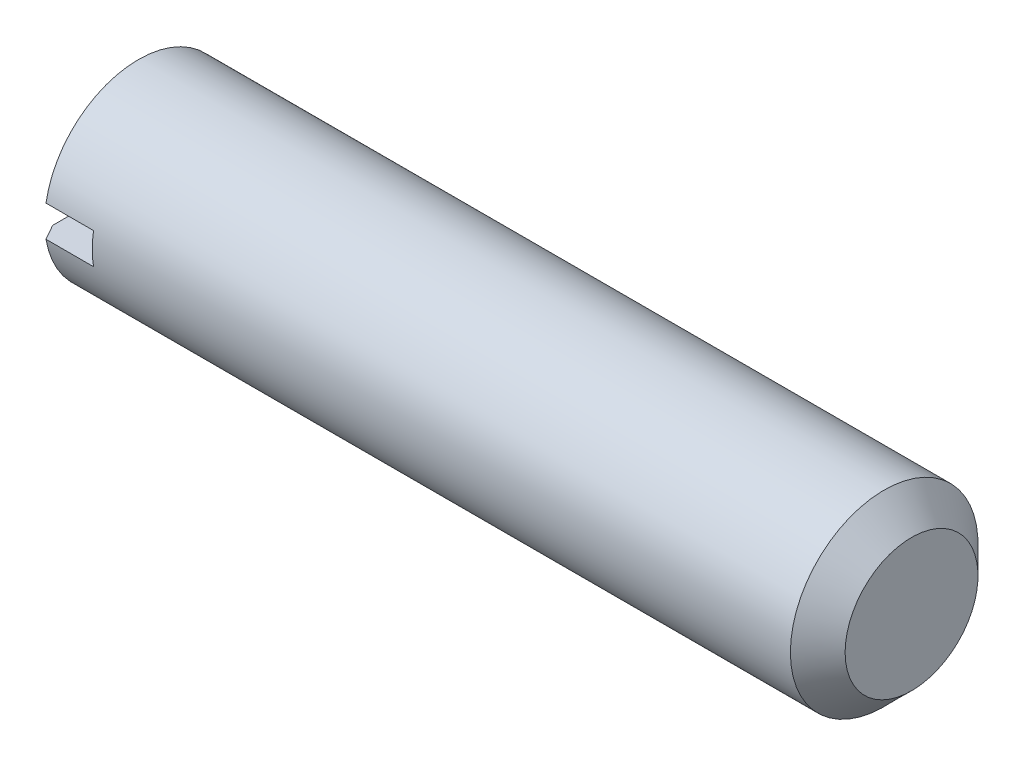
SolidWorks part; units mm, degrees
revolve "BaseBody" add sketch "BodySke"
sketch "BodySke" plane through (0, 0, 0) normal (0, 0, 1) x (1, 0, 0)
  line L0 (0.5566, -6) -> (47.1574, -6) construction
  line L1 (50, 0) -> (50, 4.25)
  line L2 (0.5566, 6) -> (48.25, 6)
  line L3 (50, 4.25) -> (48.25, 6)
  line L4 (50, 0) -> (0, 0)
  line L5 (-12.7, 0) -> (88.9, 0) construction
  line L6 (50, 4.25) -> (50, 19.05) construction
  line L7 (50, -4.25) -> (48.25, -6) construction
  line L8 (1.75, 12.7) -> (1.75, -3.175) construction
  line L9 (0, 0) -> (0, 5.036)
  line L10 (0, 5.036) -> (0.5566, 6)
  line L11 (0, -5.036) -> (0.5566, -6) construction
extrude "Slot" cut sketch "Sketch2" along normal blind 3.6
sketch "Sketch2" plane through (0, 0, 0) normal (1, 0, 0) x (0, 0, -1)
  line L1 (6, -1) -> (-6, -1)
  line L2 (6, -1) -> (6, 1)
  line L3 (6, 1) -> (-6, 1)
  line L4 (-6, -1) -> (-6, 1)
ref_plane "Plane1" through (0, 0, 0) normal (0, 0, 1) x (1, 0, 0)
ref_plane "Plane2" through (0, 0, 0) normal (0, 1, 0) x (1, 0, 0)
ref_plane "Plane3" through (0, 0, 0) normal (1, 0, 0) x (0, 0, -1)
sketch "ThdSchSke" plane through (0, 0, 0) normal (0, 0, 1) x (1, 0, 0)
  line L0 (0.5566, -5.036) -> (-0.1184, -6)
  line L1 (0.5566, -5.036) -> (1.2316, -6)
  line L2 (1.2316, -6) -> (1.2316, -7.5)
  line L3 (-3.175, 0) -> (5.1513, 0) construction
  line L5 (1.2316, -7.5) -> (-0.1184, -7.5)
  line L6 (-0.1184, -7.5) -> (-0.1184, -6)
  line L7 (0.5566, -6) -> (0.5566, -1) construction
revolve "ThreadSchematic" [suppressed] cut sketch "ThdSchSke" angle 360 about L3
pattern_linear "ThdSchPat" [suppressed]
equation "\"D1@Sketch2\" = \"Diameter@BodySke\""
equation "\"D3@Sketch2\" = \"D1@Sketch2\" / 2"
equation "\"D2@Sketch2\" = \"Slot_width@Sketch2\" / 2"
equation "\"Thread_minor@ThdSchSke\" = \"Minor_dia@BodySke\""
equation "\"Diameter@ThdSchSke\" = \"Diameter@BodySke\""
equation "\"Overcut@ThdSchSke\" = \"Diameter@BodySke\" * 1.25"
equation "\"Num_threads@ThdSchPat\" = int( (\"Length@BodySke\" - ( ( ( \"Diameter@BodySke\" - \"Minor_dia@BodySke\" ) * 0.5 ) / tan( \"Drive_ch_ang@BodySke\" * 0.017453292 ) ) - ( ( ( \"Diameter@BodySke\" - \"Cup_dia@BodySk"
equation "\"Advance@ThdSchPat\" = (\"Length@BodySke\" - ( ( ( \"Diameter@BodySke\" - \"Minor_dia@BodySke\" ) * 0.5 ) / tan( \"Drive_ch_ang@BodySke\" * 0.017453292 ) ) - ( ( ( \"Diameter@BodySke\" - \"Cup_dia@BodySke\" ) * 0."
equation "' \"Num_threads@ThdSchPat\" = \"Num_threads@ThdSchPat\" - sgn( \"Num_threads@ThdSchPat\" - 1) '---chamfered tips only---"
